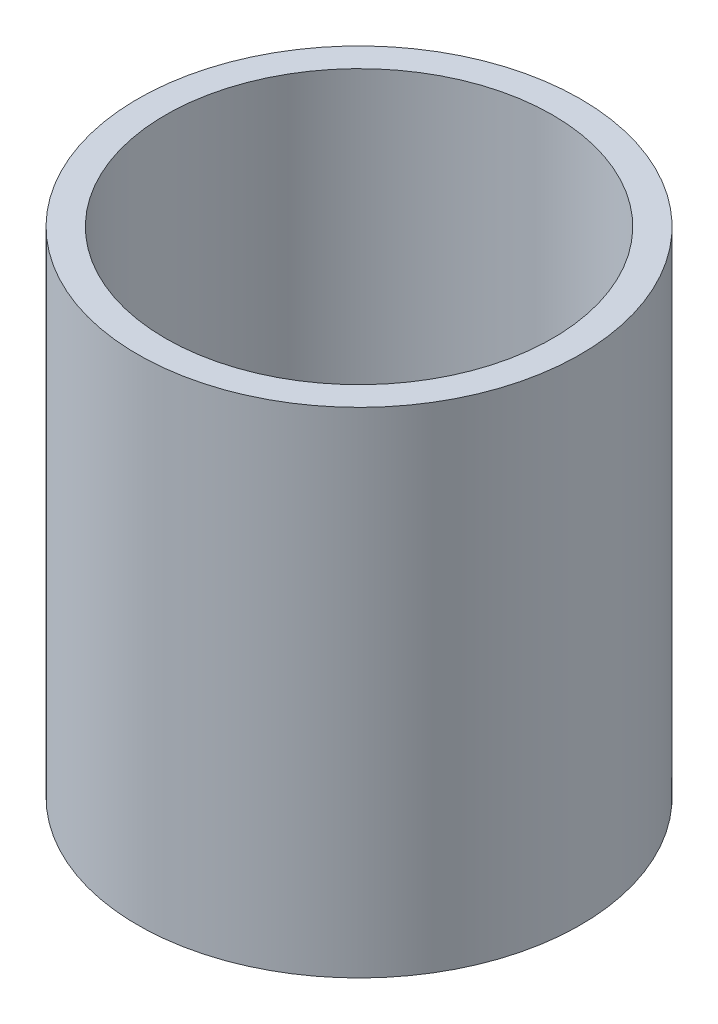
SolidWorks part; units mm, degrees
ref_plane "Front Plane" through (0, 0, 0) normal (0, 0, 1) x (1, 0, 0)
ref_plane "Top Plane" through (0, 0, 0) normal (0, 1, 0) x (1, 0, 0)
ref_plane "Right Plane" through (0, 0, 0) normal (1, 0, 0) x (0, 0, -1)
sketch "Sketch1" plane through (0, 0, 0) normal (0, 1, 0) x (1, 0, 0)
  circle A0 centre (0, 0) radius 119.38
  circle A1 centre (0, 0) radius 136.525
  dimension "D1" = 238.76
  dimension "D2" = 273.05
extrude "Boss-Extrude1" add sketch "Sketch1" along normal blind 304.8
